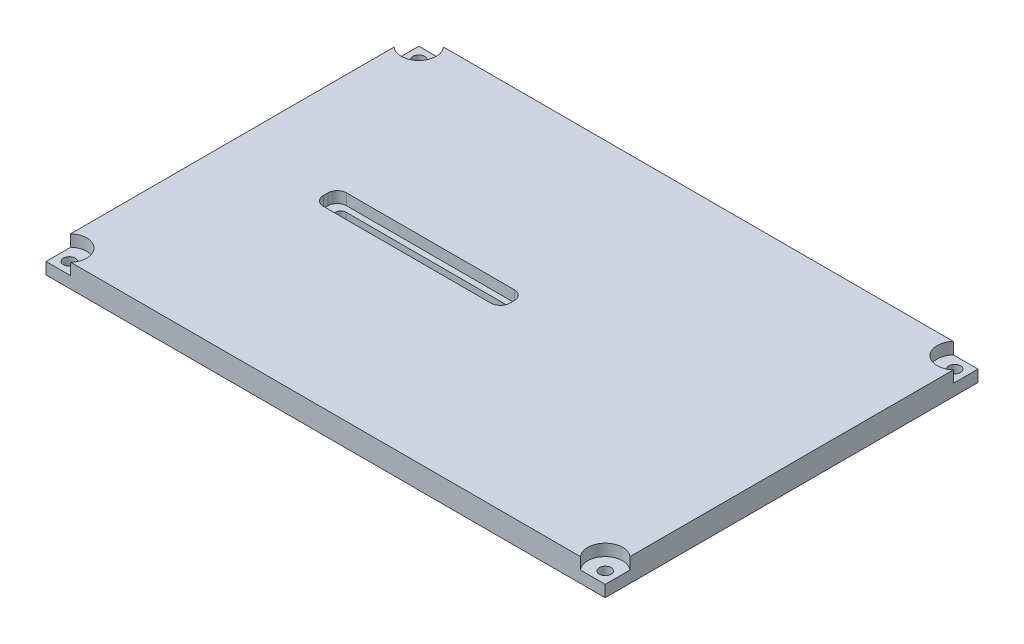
SolidWorks part; units mm, degrees
ref_plane "Front Plane" through (0, 0, 0) normal (0, 0, 1) x (1, 0, 0)
ref_plane "Top Plane" through (0, 0, 0) normal (0, 1, 0) x (1, 0, 0)
ref_plane "Right Plane" through (0, 0, 0) normal (1, 0, 0) x (0, 0, -1)
sketch "Sketch1" plane through (0, 0, 0) normal (0, 1, 0) x (1, 0, 0)
  line L1 (-76.2, -50.8) -> (76.2, -50.8)
  line L2 (-76.2, -50.8) -> (-76.2, 50.8)
  line L3 (-76.2, 50.8) -> (76.2, 50.8)
  line L4 (76.2, -50.8) -> (76.2, 50.8)
  line L5 (-76.2, -50.8) -> (76.2, 50.8) construction
  line L6 (-76.2, 50.8) -> (76.2, -50.8) construction
  point P0 (0, 0)
  dimension "D1" = 152.4
  dimension "D2" = 101.6
extrude "Extrude1" add sketch "Sketch1" along normal blind 6.35
sketch "Sketch2" plane through (0, 6.35, 0) normal (0, 1, 0) x (-1, 0, 0)
  line L0 (-76.2, 50.8) -> (-76.2, -50.8) construction
  line L1 (50.8, -3.175) -> (0, -3.175)
  line L2 (50.8, -3.175) -> (50.8, 3.175)
  line L3 (50.8, 3.175) -> (0, 3.175)
  line L4 (0, -3.175) -> (0, 3.175)
  line L5 (50.8, -3.175) -> (0, 3.175) construction
  line L6 (50.8, 3.175) -> (0, -3.175) construction
  line L7 (76.2, 0) -> (-76.2, 0) construction
  line L8 (76.2, -50.8) -> (76.2, 50.8) construction
  line L9 (76.2, 50.8) -> (-76.2, 50.8) construction
  point P0 (25.4, 0)
  dimension "D1" = 50.8
  dimension "D2" = 6.35
  dimension "D3" = 127
  dimension "D4" = 50.8
extrude "Extrude2" cut sketch "Sketch2" against normal blind 3.048
sketch "Sketch4" plane through (0, 3.302, 0) normal (0, 1, 0) x (1, 0, 0)
  line L0 (-48.26, -1.5875) -> (-2.54, 1.5875) construction
  line L1 (-48.26, 1.5875) -> (-2.54, -1.5875) construction
  line L2 (-50.8, 3.175) -> (0, -3.175) construction
  line L3 (-50.8, 3.175) -> (-50.8, -3.175) construction
  line L4 (0, 3.175) -> (-50.8, 3.175) construction
  line L5 (-50.8, -3.175) -> (0, 3.175) construction
  line L6 (-50.8, -3.175) -> (0, -3.175) construction
  line L7 (-50.8, 3.175) -> (-50.8, -3.175) construction
  line L8 (0, 3.175) -> (-50.8, 3.175) construction
  line L9 (0, -3.175) -> (0, 3.175) construction
  line L12 (-2.54, -1.5875) -> (-2.54, 1.5875)
  line L13 (-2.54, 1.5875) -> (-48.26, 1.5875)
  line L14 (-48.26, 1.5875) -> (-48.26, -1.5875)
  line L15 (-48.26, -1.5875) -> (-2.54, -1.5875)
  point P16 (-25.4, 0)
  point P17 (-25.4, 0)
  dimension "D1" = 3.175
  dimension "D2" = 2.54
extrude "Extrude4" cut sketch "Sketch4" against normal through all
fillet "Fillet2" radius 1.4351 4 edges at (-2.54, 1.651, 1.5875) (-2.54, 1.651, -1.5875) (-48.26, 1.651, 1.5875) (-48.26, 1.651, -1.5875)
fillet "Fillet3" radius 2.54 4 edges at (0, 4.826, 3.175) (0, 4.826, -3.175) (-50.8, 4.826, 3.175) (-50.8, 4.826, -3.175)
sketch "Sketch5" plane through (0, 6.35, 0) normal (0, 1, 0) x (-1, 0, 0)
  line L0 (76.2, -50.8) -> (76.2, 50.8) construction
  line L1 (76.2, 50.8) -> (-76.2, 50.8) construction
  point P0 (73.025, 47.625)
  dimension "D1" = 3.175
  dimension "D2" = 3.175
hole_wizard "CBORE for #4 Hex Machine Screw1" positions "3DSketch1" profile "Sketch6" counterbore size "#4" standard "Ansi Inch"
sketch3d "3DSketch1"
  point P0 (-73.025, 6.35, 47.625)
sketch "Sketch6" plane through (-73.025, 6.35, 47.625) normal (1, 0, 0) x (0, 0, 1)
  line L0 (0, 0) -> (0, 6.35)
  line L1 (0, 6.35) -> (1.5875, 6.35)
  line L3 (1.5875, 6.35) -> (1.5875, 3.175)
  line L4 (1.5875, 3.175) -> (4.7625, 3.175)
  line L5 (4.7625, 3.175) -> (4.7625, 0)
  line L7 (4.7625, 0) -> (0, 0)
  line L11 (0, -6.35) -> (0, 107.95) construction
  dimension "Thru Hole Dia." = 3.175
  dimension "Thru Hole Depth" = 6.35
  dimension "C'Bore Dia." = 9.525
  dimension "C'Bore Depth" = 3.175
pattern_linear "LPattern1" count 2 spacing 146.05 along (1, 0, 0) count 2 spacing 95.25 along (0, 0, -1) of "CBORE for #4 Hex Machine Screw1"
